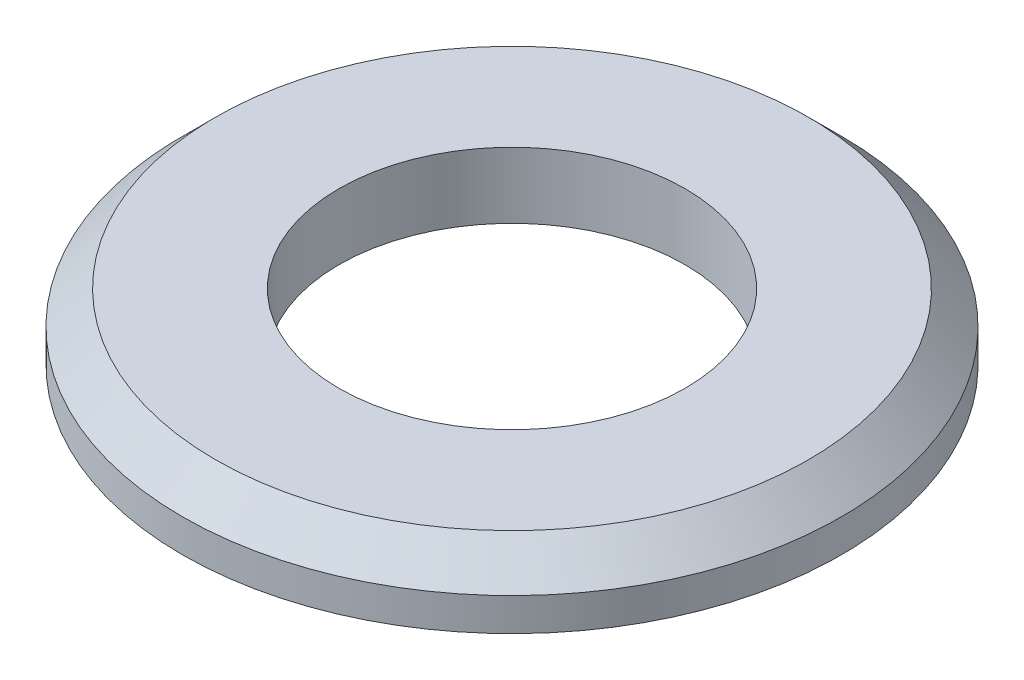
SolidWorks part; units mm, degrees
ref_plane "Front" through (0, 0, 0) normal (0, 0, 1) x (1, 0, 0)
ref_plane "Top" through (0, 0, 0) normal (0, 1, 0) x (1, 0, 0)
ref_plane "Right" through (0, 0, 0) normal (1, 0, 0) x (0, 0, -1)
sketch "Sketch1" plane through (0, 0, 0) normal (0, 1, 0) x (1, 0, 0)
  circle A0 centre (0, 0) radius 4.2
  circle A1 centre (0, 0) radius 8
extrude "Extrude1" add sketch "Sketch1" along normal blind 1.6
chamfer "Chamfer1" distance 0.8 1 edges at (0, 1.6, 8)
